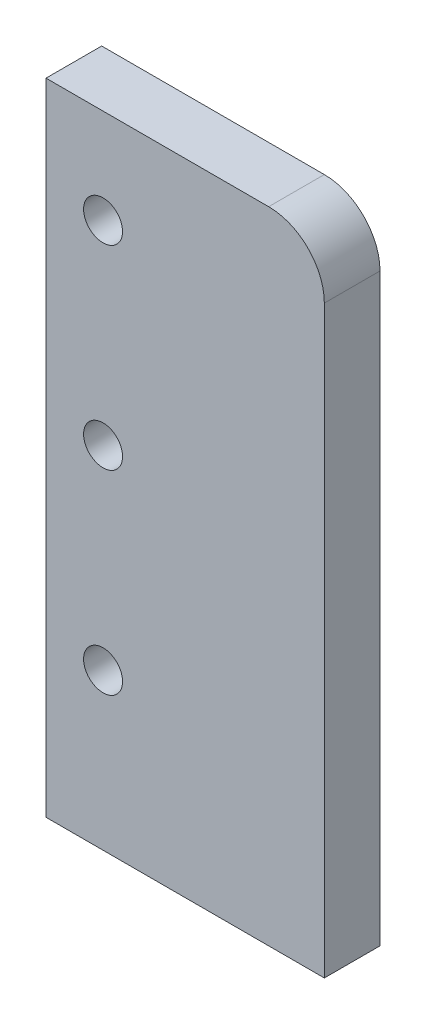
SolidWorks part; units mm, degrees
ref_plane "Face" through (0, 0, 0) normal (0, 0, 1) x (1, 0, 0)
ref_plane "Dessus" through (0, 0, 0) normal (0, 1, 0) x (1, 0, 0)
ref_plane "Droite" through (0, 0, 0) normal (1, 0, 0) x (0, 0, -1)
sketch "Esquisse1" plane through (0, 0, 0) normal (0, 0, 1) x (1, 0, 0)
  line L1 (0, 0) -> (100, 0)
  line L2 (0, 0) -> (0, 230)
  line L3 (0, 230) -> (80, 230)
  line L4 (100, 0) -> (100, 210)
  arc A0 (100, 210) -> (80, 230) centre (80, 210) ccw
  dimension "D1" = 20
  dimension "D2" = 100
  dimension "D3" = 230
extrude "Extrusion1" add sketch "Esquisse1" along normal blind 20
hole_wizard "Trou taraudé M16x2.01" positions "Esquisse3D1" profile "Esquisse2" tap size "M16x2.0" standard "Ansi Métrique"
sketch3d "Esquisse3D1"
  line L0 (20.5, 56, 20) -> (20.5, 196, 20) construction
  line L2 (0, 230, 20) -> (0, 0, 20) construction
  line L3 (0, 0, 20) -> (100, 0, 20) construction
  point P0 (20.5, 56, 20)
  point P2 (20.5, 126, 20)
  point P4 (20.5, 196, 20)
  dimension "D1" = 70
  dimension "D2" = 70
  dimension "D3" = 20.5
  dimension "D4" = 56
sketch "Esquisse2" plane through (20.5, 56, 20) normal (1, 0, 0) x (0, -1, 0)
  line L0 (0, 0) -> (0, 34.206)
  line L1 (0, 34.206) -> (7, 30)
  line L2 (7, 30) -> (7, 0)
  line L5 (7, 0) -> (0, 0)
  line L10 (0, 34.206) -> (-7, 30) construction
  line L11 (0, -6.35) -> (0, 107.95) construction
  dimension "Diamètre du trou pour taraudage" = 14
  dimension "Profondeur du trou pour taraudage" = 30
  dimension "Angle de pointe" = 118
